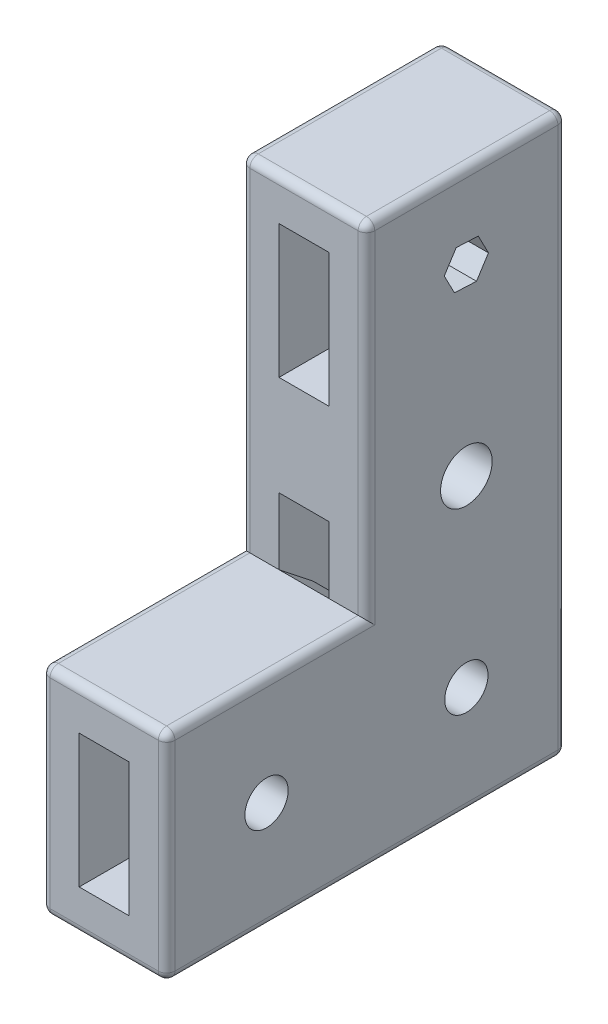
SolidWorks part; units mm, degrees
ref_plane "正面" through (0, 0, 0) normal (1, 0, 0) x (0, 1, 0)
ref_plane "平面" through (0, 0, 0) normal (0, 0, 1) x (0, 1, 0)
ref_plane "右側面" through (0, 0, 0) normal (0, 1, 0) x (-1, 0, 0)
sketch "ｽｹｯﾁ1" plane through (0, 0, 0) normal (1, 0, 0) x (0, 1, 0)
  line L0 (-35.2119, 29.3532) -> (-35.2119, -18.6468)
  line L1 (-35.2119, -18.6468) -> (31.7881, -18.6468)
  line L2 (31.7881, -18.6468) -> (31.7881, 5.3532)
  line L3 (31.7881, 5.3532) -> (-9.2119, 5.3532)
  line L4 (-9.2119, 5.3532) -> (-9.2119, 29.3532)
  line L5 (-9.2119, 29.3532) -> (-35.2119, 29.3532)
  dimension "D1" = 67
  dimension "D2" = 48
  dimension "D3" = 24
  dimension "D4" = 26
extrude "ﾎﾞｽ - 押し出し1" add sketch "ｽｹｯﾁ1" along normal blind 15
sketch "ｽｹｯﾁ2" plane through (15, 0, 0) normal (1, 0, 0) x (0, 1, 0)
  line L0 (-9.2119, 29.3532) -> (-35.2119, 29.3532) construction
  line L1 (31.7881, 5.3532) -> (-9.2119, 5.3532) construction
  line L2 (-35.2119, 29.3532) -> (-35.2119, -18.6468) construction
  line L3 (24.0244, -8.0795) -> (24.1469, -5.4265)
  line L4 (24.1469, -5.4265) -> (21.9106, -3.9939)
  line L5 (21.9106, -3.9939) -> (19.5518, -5.2142)
  line L6 (19.5518, -5.2142) -> (19.4293, -7.8672)
  line L7 (19.4293, -7.8672) -> (21.6656, -9.2998)
  line L8 (21.6656, -9.2998) -> (24.0244, -8.0795)
  circle A0 centre (-22.2119, 17.3532) radius 2.6
  circle A1 centre (-22.2119, -6.6468) radius 2.6
  circle A4 centre (-0.2119, -6.6468) radius 3.1
  circle A5 centre (21.7881, -6.6468) radius 2.3 construction
  dimension "D1" = 5.2
  dimension "D2" = 5.2
  dimension "D3" = 6.2
  dimension "D4" = 4.6
  dimension "D5" = 12
  dimension "D6" = 36
  dimension "D7" = 35
  dimension "D8" = 12
  dimension "D9" = 13
  dimension "D10" = 13
  dimension "D11" = 36
  dimension "D12" = 57
extrude "ｶｯﾄ - 押し出し1" cut sketch "ｽｹｯﾁ2" against normal through all
sketch "ｽｹｯﾁ3" plane through (0, 0, 5.3532) normal (0, 0, 1) x (1, 0, 0)
  line L0 (15, -9.2119) -> (0, -9.2119) construction
  line L1 (4.5, -9.2119) -> (10.5, -9.2119)
  line L2 (4.5, -9.2119) -> (4.5, -1.2119)
  line L3 (4.5, -1.2119) -> (10.5, -1.2119)
  line L4 (10.5, -9.2119) -> (10.5, -1.2119)
  line L5 (15, 31.7881) -> (15, -9.2119) construction
  dimension "D1" = 6
  dimension "D2" = 4.5
  dimension "D3" = 8
sketch "ｽｹｯﾁ4" plane through (0, 0, -18.6468) normal (0, 0, -1) x (1, 0, 0)
  line L1 (4.5, 28.2119) -> (10.5, 28.2119)
  line L2 (4.5, 28.2119) -> (4.5, 16.2119)
  line L3 (4.5, 16.2119) -> (10.5, 16.2119)
  line L4 (10.5, 28.2119) -> (10.5, 16.2119)
  line L5 (4.5, 28.2119) -> (10.5, 16.2119) construction
  line L6 (4.5, 16.2119) -> (10.5, 28.2119) construction
  line L7 (15, 35.2119) -> (0, 35.2119) construction
  line L8 (15, 35.2119) -> (15, -31.7881) construction
  point P0 (7.5, 22.2119)
  dimension "D1" = 13
  dimension "D2" = 6
  dimension "D3" = 4.5
  dimension "D4" = 12
loft "ｶｯﾄ - ﾛﾌﾄ1" cut profiles "ｽｹｯﾁ4", "ｽｹｯﾁ3"
sketch "ｽｹｯﾁ5" plane through (0, 0, -18.6468) normal (0, 0, -1) x (1, 0, 0)
  line L0 (15, 35.2119) -> (0, 35.2119) construction
  line L1 (4.5, 30.2119) -> (10.5, 30.2119)
  line L2 (4.5, 30.2119) -> (4.5, 14.2119)
  line L3 (4.5, 14.2119) -> (10.5, 14.2119)
  line L4 (10.5, 30.2119) -> (10.5, 14.2119)
  line L5 (4.5, 30.2119) -> (10.5, 14.2119) construction
  line L6 (4.5, 14.2119) -> (10.5, 30.2119) construction
  line L7 (4.5, -10.7881) -> (10.5, -10.7881)
  line L8 (4.5, -10.7881) -> (4.5, -26.7881)
  line L9 (4.5, -26.7881) -> (10.5, -26.7881)
  line L10 (10.5, -10.7881) -> (10.5, -26.7881)
  line L11 (4.5, -10.7881) -> (10.5, -26.7881) construction
  line L12 (4.5, -26.7881) -> (10.5, -10.7881) construction
  line L13 (15, 35.2119) -> (15, -31.7881) construction
  line L14 (15, -31.7881) -> (0, -31.7881) construction
  point P0 (7.5, 22.2119)
  point P5 (7.5, -18.7881)
  dimension "D1" = 6
  dimension "D2" = 13
  dimension "D3" = 4.5
  dimension "D4" = 16
  dimension "D5" = 6
  dimension "D6" = 4.5
  dimension "D7" = 13
  dimension "D8" = 16
extrude "ｶｯﾄ - 押し出し2" cut sketch "ｽｹｯﾁ5" against normal through all
fillet "ﾌｨﾚｯﾄ1" radius 1 1 edges at (7.5, -14.2119, -0.9626)
fillet "ﾌｨﾚｯﾄ2" radius 1 17 edges at (0, -1.7119, -18.6468) (7.5, 31.7881, -18.6468) (0, 31.7881, -6.6468) (7.5, 31.7881, 5.3532) (15, 31.7881, -6.6468) (15, -1.7119, -18.6468) (15, 11.2881, 5.3532) (15, -9.2119, 17.3532) (0, -9.2119, 17.3532) (0, 11.2881, 5.3532) (7.5, -35.2119, -18.6468) (15, -35.2119, 5.3532) (0, -35.2119, 5.3532) (15, -22.2119, 29.3532) (7.5, -35.2119, 29.3532) (0, -22.2119, 29.3532) (7.5, -9.2119, 29.3532)
